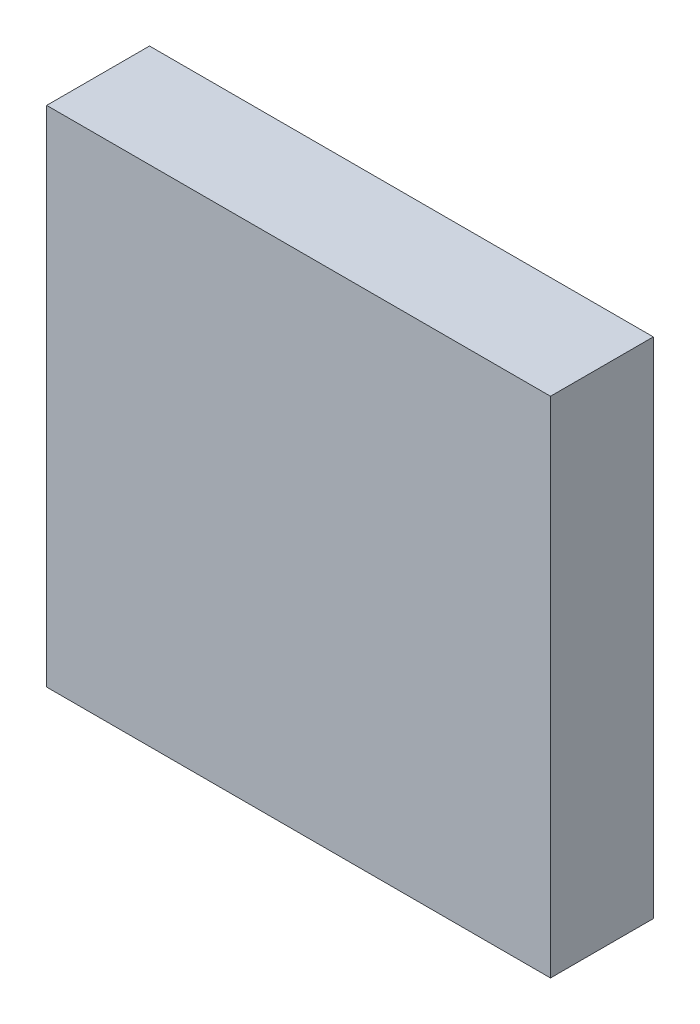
SolidWorks part; units mm, degrees
ref_plane "Front Plane" through (0, 0, 0) normal (0, 0, 1) x (1, 0, 0)
ref_plane "Top Plane" through (0, 0, 0) normal (0, 1, 0) x (1, 0, 0)
ref_plane "Right Plane" through (0, 0, 0) normal (1, 0, 0) x (0, 0, -1)
sketch "Sketch1" plane through (0, 0, 0) normal (0, 0, 1) x (1, 0, 0)
  line L1 (0, 0) -> (4.9, 0)
  line L2 (0, 0) -> (0, 4.9)
  line L3 (0, 4.9) -> (4.9, 4.9)
  line L4 (4.9, 0) -> (4.9, 4.9)
  dimension "D1" = 4.9
extrude "Extrude1" add sketch "Sketch1" along normal blind 1
